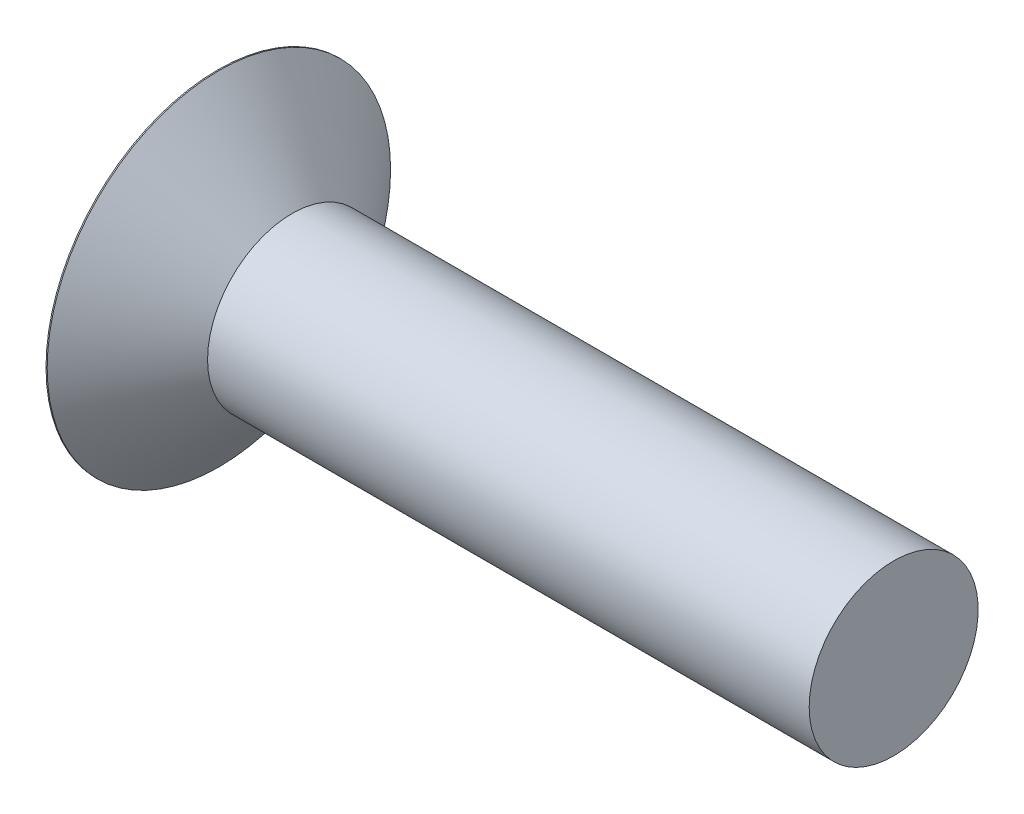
SolidWorks part; units mm, degrees
ref_plane "Plane1" through (0, 0, 0) normal (0, 0, 1) x (1, 0, 0)
ref_plane "Plane2" through (0, 0, 0) normal (0, 1, 0) x (1, 0, 0)
ref_plane "Plane3" through (0, 0, 0) normal (1, 0, 0) x (0, 0, -1)
sketch "BodySke" plane through (0, 0, 0) normal (0, 0, 1) x (1, 0, 0)
  line L0 (0, 0) -> (0, 9.6774)
  line L1 (0, 9.6774) -> (0.0669, 9.6774)
  line L2 (4.191, 4.7625) -> (38.1, 4.7625)
  line L3 (38.1, 4.7625) -> (38.1, 0)
  line L4 (38.1, 0) -> (0, 0)
  line L5 (-6.35, 0) -> (82.55, 0) construction
  line L6 (4.191, -4.7625) -> (38.1, -4.7625) construction
  line L7 (0.0669, -9.6774) -> (4.191, -4.7625) construction
  line L8 (0.0669, 9.6774) -> (4.191, 4.7625)
  line L9 (0, -9.6774) -> (0.0669, -9.6774) construction
  line L10 (5.7785, 6.35) -> (5.7785, -3.175) construction
  line L11 (6.35, 6.35) -> (6.35, -3.175) construction
  dimension "Diameter" = 9.525
  dimension "Length" = 38.1
  dimension "Head_ht" = 4.191
  dimension "Head_dia" = 19.3548
  dimension "Head_ang" = 100
  dimension "D6" = 0.0669
  dimension "Advance" = 1.5875
  dimension "Thread_nom" = 31.75
revolve "Base-Revolve" add sketch "BodySke" angle 360 about L5
sketch "Sketch2" plane through (0, 0, 0) normal (-1, 0, 0) x (0, 0, 1)
  line L0 (-9.6774, -1.1938) -> (9.6774, -1.1938)
  line L1 (-9.6774, -1.1938) -> (-9.6774, 1.1938)
  line L2 (9.6774, 1.1938) -> (-9.6774, 1.1938)
  line L3 (9.6774, 1.1938) -> (9.6774, -1.1938)
  dimension "D1" = 1.1938
  dimension "Slot_width" = 2.3876
  dimension "D2" = 19.3548
  dimension "D3" = 9.6774
extrude "Slot" [suppressed] cut sketch "Sketch2" against normal blind 2.2352
sketch "Sketch3" plane through (0, 0, 0) normal (-1, 0, 0) x (0, 0, 1)
  line L0 (-1.0922, 6.6421) -> (1.0922, 6.6421)
  line L1 (1.0922, 6.6421) -> (1.0922, -6.6421)
  line L2 (1.0922, -6.6421) -> (-1.0922, -6.6421)
  line L3 (-1.0922, -6.6421) -> (-1.0922, 6.6421)
  dimension "D1" = 6.6421
  dimension "Cross_dia" = 13.2842
  dimension "D2" = 1.0922
  dimension "Cross_width" = 2.1844
ref_plane "Plane4" through (7.9756, 0, 0) normal (-1, 0, 0) x (0, 0, 1)
sketch "Sketch4" plane through (7.9756, 0, 0) normal (-1, 0, 0) x (0, 0, 1)
  line L0 (-0.5461, 0.5461) -> (0.5461, 0.5461)
  line L3 (0.5461, 0.5461) -> (0.5461, -0.5461)
  line L4 (0.5461, -0.5461) -> (-0.5461, -0.5461)
  line L5 (-0.5461, -0.5461) -> (-0.5461, 0.5461)
  dimension "D1" = 1.0922
  dimension "D2" = 1.0922
  dimension "D3" = 0.5461
  dimension "D4" = 0.5461
loft "Cross" cut profiles "Sketch3", "Sketch4"
pattern_circular "CirPattern1" count 2 every 90 about axis through (0, 0, 0) along (1, 0, 0) of "Cross"
sketch "ThdSchSke" plane through (0, 0, 0) normal (0, 0, 1) x (1, 0, 0)
  line L0 (6.35, -3.9624) -> (5.7898, -4.7625)
  line L1 (6.35, -3.9624) -> (6.9103, -4.7625)
  line L2 (6.9103, -4.7625) -> (6.9103, -5.9531)
  line L3 (-3.175, 0) -> (5.1513, 0) construction
  line L5 (6.9103, -5.9531) -> (5.7898, -5.9531)
  line L6 (5.7898, -5.9531) -> (5.7898, -4.7625)
  line L7 (0, 9.6774) -> (0, -9.6774) construction
  dimension "Thread_minor" = 7.9248
  dimension "Diameter" = 9.525
  dimension "Start" = 6.35
  dimension "SideAngle" = 55
  dimension "VeeAngle" = 70
  dimension "Overcut" = 11.9063
revolve "ThreadSchematic" [suppressed] cut sketch "ThdSchSke" angle 360 about L3
pattern_linear "ThdSchPat" [suppressed]
equation "\"D1@Sketch3\" = \"Cross_dia@Sketch3\" / 2"
equation "\"D2@Sketch3\" = \"Cross_width@Sketch3\" / 2"
equation "\"D1@Sketch4\" = \"Cross_width@Sketch3\" *.5"
equation "\"D2@Sketch4\" = \"D1@Sketch4\""
equation "\"D4@Sketch4\" = \"D2@Sketch4\" / 2"
equation "\"D3@Sketch4\" = \"D1@Sketch4\" / 2"
equation "\"D1@Sketch2\" = \"Slot_width@Sketch2\" / 2"
equation "\"D2@Sketch2\" = \"Head_dia@BodySke\""
equation "\"D3@Sketch2\" = \"D2@Sketch2\" / 2"
equation "\"Thread_length@ThreadCosmetic\" = ((sgn( (\"Length@BodySke\" - \"Advance@BodySke\" - \"Head_ht@BodySke\" ) - \"Thread_nom@BodySke\" )-1)*( (\"Length@BodySke\" - \"Advance@BodySke\" - \"Head_ht@BodySke\" ) - \"Thread_"
equation "\"Thread_minor@ThdSchSke\" = \"Thread_minor@ThreadCosmetic\""
equation "\"Diameter@ThdSchSke\" = \"Diameter@BodySke\""
equation "\"Overcut@ThdSchSke\" = \"Diameter@BodySke\" * 1.25"
equation "\"Start@ThdSchSke\" = 0.000001 + \"Length@BodySke\" - \"Thread_length@ThreadCosmetic\"  '---Countersunk---"
equation "\"Num_threads@ThdSchPat\" = int( \"Thread_length@ThreadCosmetic\" / \"Advance@BodySke\" + 0.999 )  + 1"
equation "\"Advance@ThdSchPat\" = \"Thread_length@ThreadCosmetic\" /  (\"Num_threads@ThdSchPat\" - 1) 'relax it"
